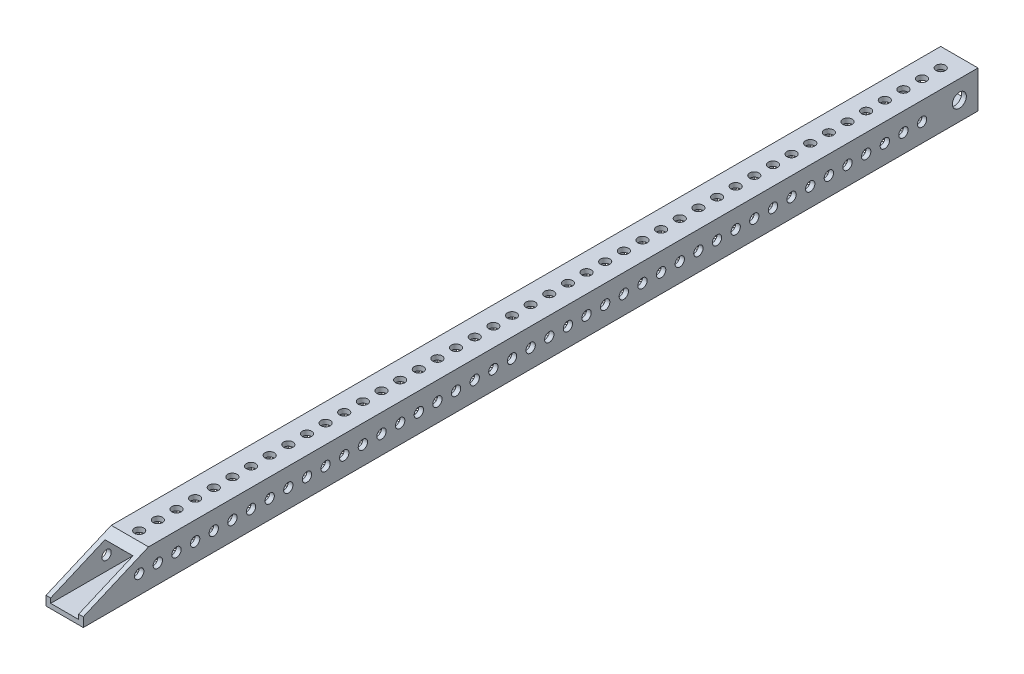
SolidWorks part; units mm, degrees
ref_plane "Front" through (0, 0, 0) normal (0, 0, 1) x (1, 0, 0)
ref_plane "Top" through (0, 0, 0) normal (0, 1, 0) x (1, 0, 0)
ref_plane "Right" through (0, 0, 0) normal (1, 0, 0) x (0, 0, -1)
sketch "Sketch1" plane through (0, 0, 0) normal (0, 0, 1) x (1, 0, 0)
  line L0 (-9.525, 9.525) -> (-9.525, 12.7) construction
  line L1 (12.7, -12.7) -> (-12.7, -12.7)
  line L2 (12.7, -12.7) -> (12.7, 12.7)
  line L3 (12.7, 12.7) -> (-12.7, 12.7)
  line L4 (-12.7, -12.7) -> (-12.7, 12.7)
  line L5 (12.7, -12.7) -> (-12.7, 12.7) construction
  line L6 (12.7, 12.7) -> (-12.7, -12.7) construction
  line L7 (9.525, -9.525) -> (-9.525, -9.525)
  line L8 (9.525, -9.525) -> (9.525, 9.525)
  line L9 (9.525, 9.525) -> (-9.525, 9.525)
  line L10 (-9.525, -9.525) -> (-9.525, 9.525)
  line L11 (9.525, -9.525) -> (-9.525, 9.525) construction
  line L12 (9.525, 9.525) -> (-9.525, -9.525) construction
  line L13 (-9.525, 9.525) -> (-12.7, 9.525) construction
  point P0 (0, 0)
  point P5 (0, 0)
  dimension "D1" = 3.175
  dimension "D2" = 25.4
  dimension "D3" = 25.4
extrude "Boss-Extrude1" add sketch "Sketch1" along normal blind 609.6
sketch "Sketch2" plane through (-12.7, 0, 0) normal (-1, 0, 0) x (0, 0, 1)
  line L0 (609.6, -12.7) -> (609.6, -6.35) construction
  line L1 (609.6, -12.7) -> (609.6, 12.7) construction
  line L2 (609.6, -6.35) -> (565.15, 12.7)
  line L3 (609.6, 12.7) -> (0, 12.7) construction
  line L4 (609.6, -6.35) -> (609.6, 12.7)
  line L5 (609.6, 12.7) -> (565.15, 12.7)
  circle A0 centre (12.7, 0) radius 4.7625
  dimension "D1" = 12.7
  dimension "D2" = 9.525
  dimension "D3" = 44.45
  dimension "D4" = 6.35
extrude "Cut-Extrude1" cut sketch "Sketch2" against normal through all
sketch "Sketch3" plane through (0, 12.7, 0) normal (0, 1, 0) x (1, 0, 0)
  line L0 (12.7, 0) -> (-12.7, 0) construction
  circle A0 centre (0, -12.7) radius 3.175
  dimension "D1" = 6.35
  dimension "D2" = 12.7
extrude "Cut-Extrude2" cut sketch "Sketch3" against normal through all
pattern_linear "LPattern1" count 44 spacing 12.7 along (0, 0, 1) of "Cut-Extrude2"
sketch "Sketch4" plane through (12.7, 0, 0) normal (1, 0, 0) x (0, 0, -1)
  line L0 (0, -12.7) -> (0, 12.7) construction
  line L1 (-38.1, 0) -> (0, 0) construction
  circle A0 centre (-38.1, 0) radius 3.175
  dimension "D1" = 38.1
  dimension "D2" = 6.35
extrude "Cut-Extrude3" cut sketch "Sketch4" against normal through all
pattern_linear "LPattern2" count 43 spacing 12.7 along (0, 0, 1) of "Cut-Extrude3"
